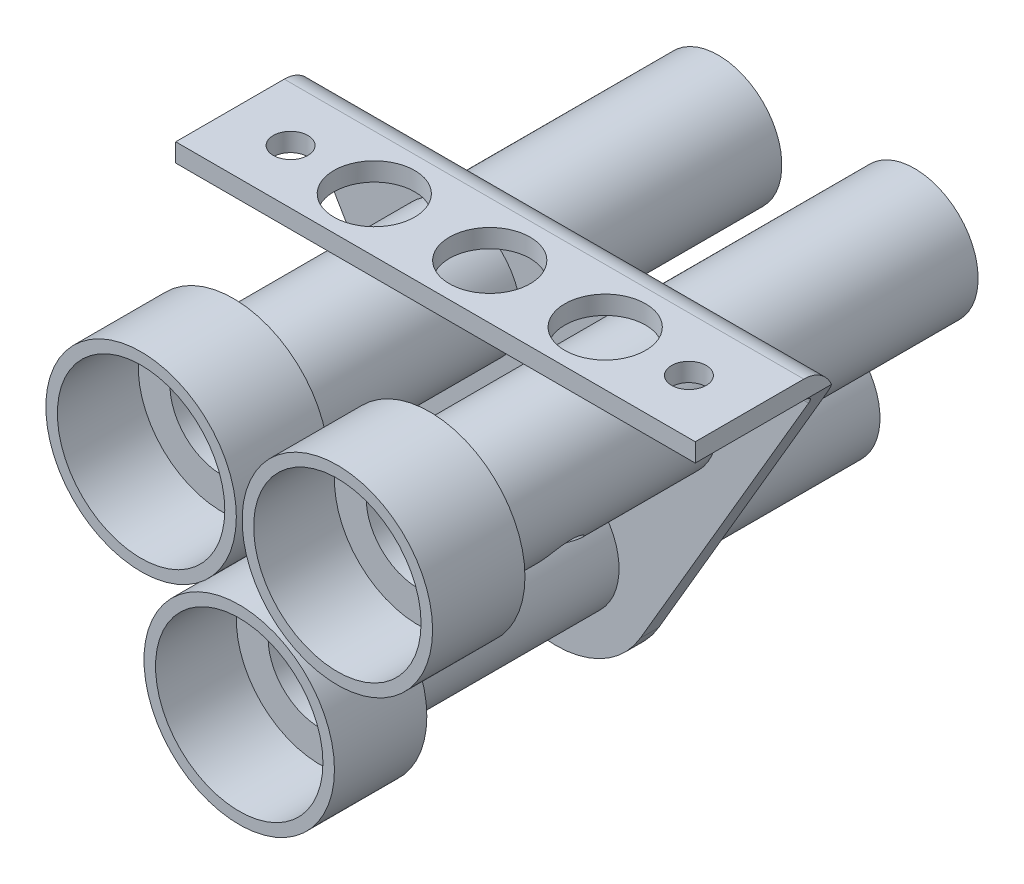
SolidWorks part; units mm, degrees
ref_plane "Face" through (0, 0, 0) normal (0, 0, 1) x (1, 0, 0)
ref_plane "Dessus" through (0, 0, 0) normal (0, 1, 0) x (1, 0, 0)
ref_plane "Côté" through (0, 0, 0) normal (1, 0, 0) x (0, 0, -1)
sketch "Esquisse1" plane through (0, 0, 0) normal (0, 0, 1) x (1, 0, 0)
  circle A0 centre (-8.5, -8.5) radius 5.5
  circle A1 centre (8.5, -8.5) radius 5.5
  circle A2 centre (0, -23.2224) radius 5.5
  circle A3 centre (-8.5, -8.5) radius 4.5
  circle A4 centre (8.5, -8.5) radius 4.5
  circle A5 centre (0, -23.2224) radius 4.5
  dimension "D1" = 11
  dimension "D2" = 28
  dimension "D3" = 28
  dimension "D4" = 28
  dimension "D5" = 3
  dimension "D6" = 1
  dimension "D7" = 1
  dimension "D8" = 1
extrude "Boss.-Extru.1" add sketch "Esquisse1" along normal blind 42
sketch "Esquisse2" plane through (0, 0, 42) normal (0, 0, 1) x (1, 0, 0)
  circle A0 centre (-8.5, -8.5) radius 8.25
  circle A1 centre (8.5, -8.5) radius 8.25
  circle A2 centre (0, -23.2224) radius 8.25
  circle A3 centre (-8.5, -8.5) radius 4.5 construction
  circle A4 centre (-8.5, -8.5) radius 4.5
  circle A5 centre (8.5, -8.5) radius 4.5 construction
  circle A6 centre (8.5, -8.5) radius 4.5
  circle A7 centre (0, -23.2224) radius 4.5 construction
  circle A8 centre (0, -23.2224) radius 4.5
  dimension "D1" = 16.5
extrude "Boss.-Extru.2" add sketch "Esquisse2" along normal blind 1
sketch "Esquisse3" plane through (0, 0, 43) normal (0, 0, 1) x (1, 0, 0)
  circle A0 centre (-8.5, -8.5) radius 7.25
  circle A1 centre (-8.5, -8.5) radius 8.25
  circle A2 centre (-8.5, -8.5) radius 8.25
  circle A3 centre (8.5, -8.5) radius 8.25
  circle A4 centre (8.5, -8.5) radius 8.25
  circle A5 centre (0, -23.2224) radius 8.25
  circle A6 centre (0, -23.2224) radius 8.25
  circle A7 centre (8.5, -8.5) radius 7.25
  circle A8 centre (0, -23.2224) radius 7.25
  dimension "D1" = 0
  dimension "D2" = 0
  dimension "D3" = 0
  dimension "D4" = 1
  dimension "D5" = 1
  dimension "D6" = 1
extrude "Boss.-Extru.3" add sketch "Esquisse3" along normal blind 7
ref_plane "Plan1" through (0, 0, 21) normal (0, 0, -1) x (-1, 0, 0)
sketch "Esquisse4" plane through (0, 0, 21) normal (0, 0, -1) x (-1, 0, 0)
  line L0 (-22.5, 0) -> (22.5, 0)
  line L1 (-22.5, 0) -> (-22.5, -1.6)
  line L2 (-22.5, -1.6) -> (-7.3364, -27.5151)
  line L3 (0, -23.2224) -> (0, -13.4075) construction
  line L4 (0, -13.4075) -> (-8.5, -8.5) construction
  line L5 (0, -13.4075) -> (8.5, -8.5) construction
  line L6 (22.5, 0) -> (22.5, -1.6)
  line L7 (22.5, -1.6) -> (7.3364, -27.5151)
  arc A0 (-7.3364, -27.5151) -> (7.3364, -27.5151) centre (0, -23.2224) ccw
  circle A1 centre (0, -13.4075) radius 2
  circle A2 centre (0, -23.2224) radius 5.5 construction
  circle A3 centre (0, -23.2224) radius 5.5
  circle A4 centre (8.5, -8.5) radius 5.5 construction
  circle A5 centre (8.5, -8.5) radius 5.5
  circle A6 centre (-8.5, -8.5) radius 5.5 construction
  circle A7 centre (-8.5, -8.5) radius 5.5
  dimension "D2" = 17
  dimension "D3" = 4
  dimension "D1" = 45
  dimension "D4" = 1.6
extrude "Boss.-Extru.4" add sketch "Esquisse4" against normal blind 1.6
sketch "Esquisse5" plane through (0, 0, 0) normal (0, 1, 0) x (1, 0, 0)
  line L1 (22.5, -21) -> (-22.5, -21)
  line L2 (22.5, -21) -> (22.5, -33)
  line L3 (22.5, -33) -> (-22.5, -33)
  line L4 (-22.5, -21) -> (-22.5, -33)
  line L5 (-22.5, -22.6) -> (-22.5, -21) construction
  dimension "D1" = 12
extrude "Boss.-Extru.5" add sketch "Esquisse5" against normal blind 1.6
fillet "Congé1" radius 1 1 edges at (0, -1.6, 22.6)
fillet "Congé2" radius 2.6 1 edges at (0, 0, 21)
sketch "Esquisse6" plane through (0, 0, 0) normal (0, 1, 0) x (1, 0, 0)
  line L0 (0, 0) -> (0, -54.4929) construction
  line L1 (-22.5, -33) -> (22.5, -33) construction
  circle A0 centre (-17.25, -28.3) radius 1.5
  circle A1 centre (17.25, -28.3) radius 1.5
  circle A2 centre (10, -28.3) radius 3.5
  circle A3 centre (0, -28.3) radius 3.5
  circle A4 centre (-10, -28.3) radius 3.5
  dimension "D1" = 7
  dimension "D2" = 3
  dimension "D3" = 4.7
  dimension "D4" = 3
  dimension "D5" = 17.25
  dimension "D6" = 17.25
  dimension "D7" = 10
  dimension "D8" = 10
extrude "Enlèv. mat.-Extru.1" cut sketch "Esquisse6" against normal up to next
ref_plane "Plan2" through (7.6974, -9.1734, 0) normal (0.6428, -0.766, 0) x (0.766, 0.6428, 0)
ref_plane "Plan3" through (-7.6974, -9.1734, 0) normal (0.6428, 0.766, 0) x (-0.766, 0.6428, 0)
sketch "Esquisse7" plane through (7.6974, -9.1734, 0) normal (0.6428, -0.766, 0) x (0.766, 0.6428, 0)
  line L0 (1.0477, 21) -> (1.0477, 0) construction
  line L2 (1.0477, 42) -> (1.0477, 22.6) construction
  line L3 (15.1165, 22.6) -> (-12.0664, 22.6) construction
  circle A0 centre (1.0477, 34.6) radius 2
  dimension "D1" = 4
  dimension "D2" = 12
extrude "Enlèv. mat.-Extru.2" cut sketch "Esquisse7" along normal through all
sketch "Esquisse8" plane through (-7.6974, -9.1734, 0) normal (0.6428, 0.766, 0) x (-0.766, 0.6428, 0)
  line L0 (1.0477, 42) -> (1.0477, 22.6) construction
  line L1 (-12.0664, 22.6) -> (15.1165, 22.6) construction
  circle A0 centre (1.0477, 34.6) radius 2
  dimension "D1" = 12
  dimension "D2" = 4
extrude "Enlèv. mat.-Extru.3" cut sketch "Esquisse8" against normal through all
ref_plane "Plan fixation" through (0, 0, 28.3) normal (0, 0, 1) x (1, 0, 0)
ref_plane "Plan5" through (10.59, -12.6206, 0) normal (0.6428, -0.766, 0) x (0.766, 0.6428, 0)
ref_plane "Plan6" through (-10.59, -12.6206, 0) normal (0.6428, 0.766, 0) x (-0.766, 0.6428, 0)
ref_plane "Plan7" through (5.8056, -10.0556, 0) normal (0.5, -0.866, 0) x (0.866, 0.5, 0)
sketch "Esquisse9" plane through (0, 0, 50) normal (0, 0, 1) x (1, 0, 0)
  point P0 (8.5, -8.5)
  point P1 (-8.5, -8.5)
  point P3 (0, -23.2224)
